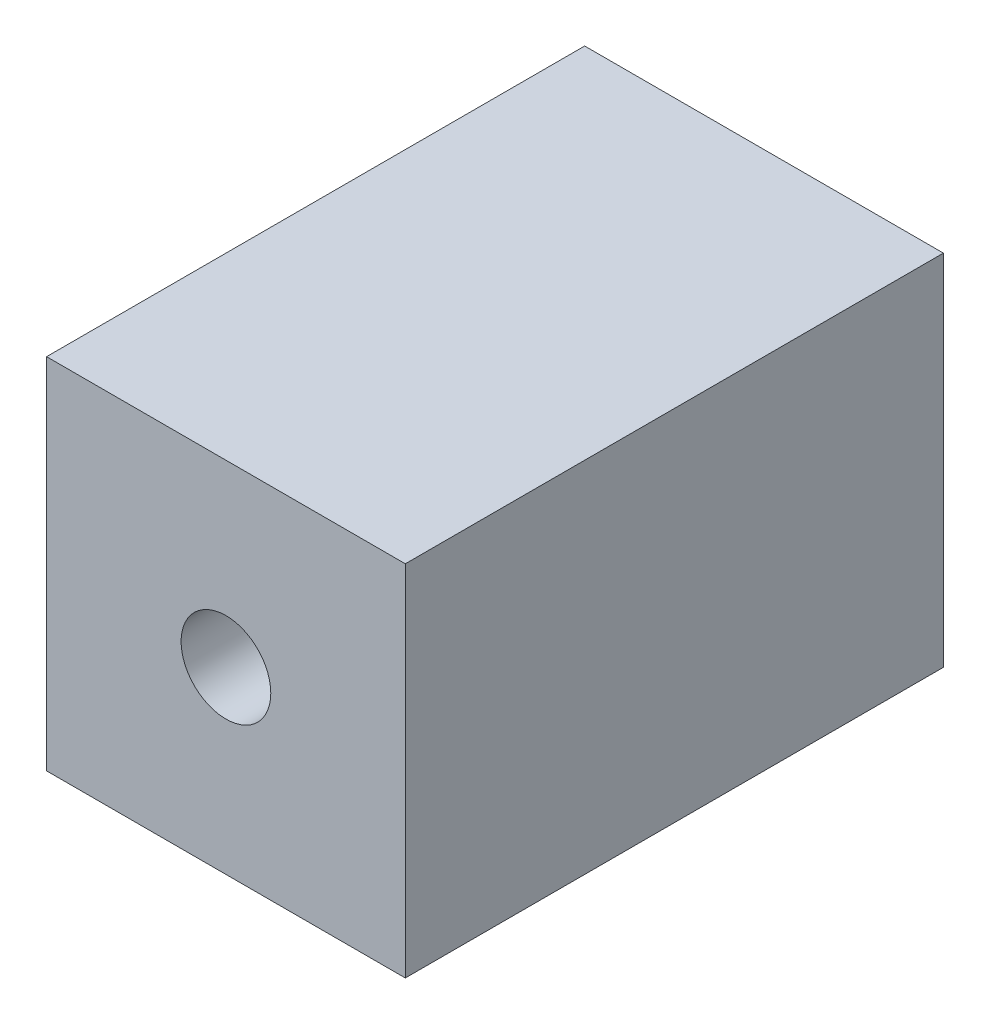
SolidWorks part; units mm, degrees
ref_plane "Front Plane" through (0, 0, 0) normal (0, 0, 1) x (1, 0, 0)
ref_plane "Top Plane" through (0, 0, 0) normal (0, 1, 0) x (1, 0, 0)
ref_plane "Right Plane" through (0, 0, 0) normal (1, 0, 0) x (0, 0, -1)
sketch "Sketch1" plane through (0, 0, 0) normal (0, 0, 1) x (1, 0, 0)
  line L1 (0, 0) -> (20, 0)
  line L2 (0, 0) -> (0, -20)
  line L3 (0, -20) -> (20, -20)
  line L4 (20, 0) -> (20, -20)
  dimension "D1" = 20
  dimension "D2" = 20
extrude "Boss-Extrude1" add sketch "Sketch1" along normal blind 30
sketch "Sketch2" plane through (0, 0, 30) normal (0, 0, 1) x (1, 0, 0)
  line L0 (10, 0) -> (10, -20) construction
  line L1 (20, 0) -> (0, 0) construction
  line L2 (0, -20) -> (20, -20) construction
  circle A0 centre (10, -10) radius 2.5
  dimension "D1" = 5
extrude "Cut-Extrude1" cut sketch "Sketch2" against normal blind 5
